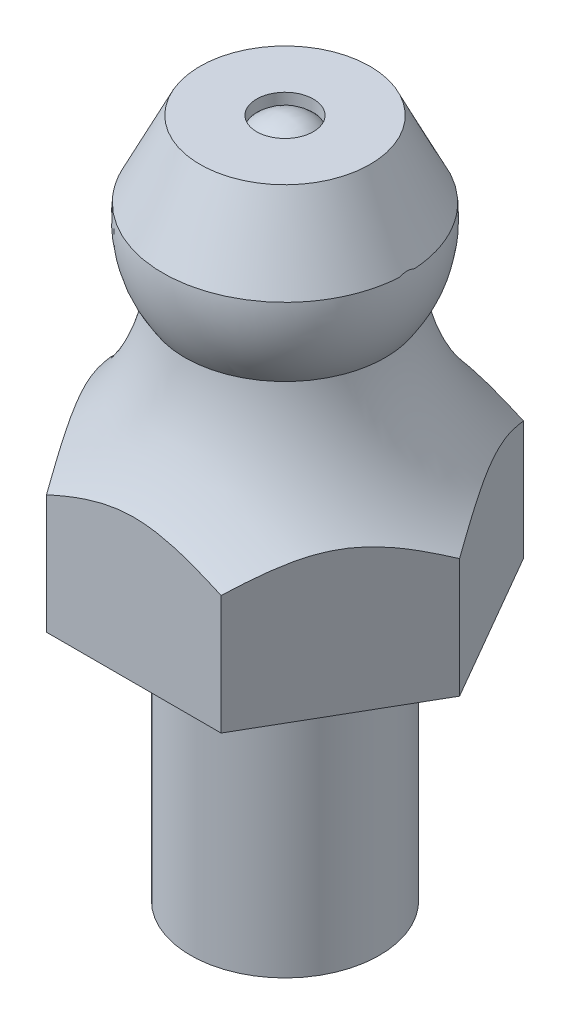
SolidWorks part; units mm, degrees
other "旋转3"
other "旋转2"
ref_plane "前视基准面" through (0, 0, 0) normal (0, 0, 1) x (1, 0, 0)
ref_plane "上视基准面" through (0, 0, 0) normal (0, 1, 0) x (1, 0, 0)
ref_plane "右视基准面" through (0, 0, 0) normal (1, 0, 0) x (0, 0, -1)
imported_body "输入1"
imported_body "输入2"
sketch "草图1" plane through (0, 0.7, 0) normal (0, -1, 0) x (1, 0, 0)
  circle A0 centre (0, 0) radius 2.5
  dimension "D1" = 5
extrude "切除-拉伸1" cut sketch "草图1" against normal up to surface (5.3 mm away) flip side to cut
sketch "草图2" plane through (0, 6, 0) normal (0, -1, 0) x (1, 0, 0)
  line L0 (0, -5.5) -> (3.1754, -5.5) construction
  line L1 (2.3094, -4) -> (4.6188, 0)
  line L2 (4.6188, 0) -> (2.3094, 4)
  line L3 (2.3094, 4) -> (-2.3094, 4)
  line L4 (-2.3094, 4) -> (-4.6188, 0)
  line L5 (-4.6188, 0) -> (-2.3094, -4)
  line L6 (-2.3094, -4) -> (2.3094, -4)
  circle A0 centre (0, 0) radius 4 construction
  dimension "D1" = 8
extrude "切除-拉伸2" cut sketch "草图2" against normal through all flip side to cut
sketch "草图3" plane through (0, 6, 0) normal (0, -1, 0) x (1, 0, 0)
  circle A0 centre (0, 0) radius 6.3034
  circle A1 centre (0, 0) radius 2.5 construction
  circle A2 centre (0, 0) radius 2.5
extrude "切除-拉伸3" cut sketch "草图3" against normal blind 1
